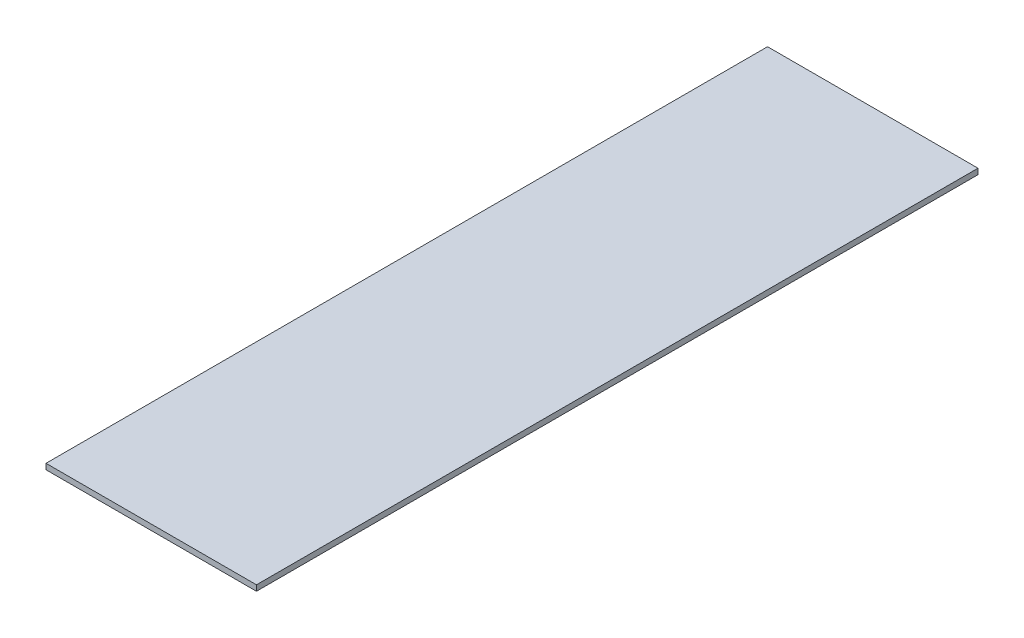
SolidWorks part; units mm, degrees
ref_plane "Front Plane" through (0, 0, 0) normal (0, 0, 1) x (1, 0, 0)
ref_plane "Top Plane" through (0, 0, 0) normal (0, 1, 0) x (1, 0, 0)
ref_plane "Right Plane" through (0, 0, 0) normal (1, 0, 0) x (0, 0, -1)
sketch "Sketch1" plane through (0, 0, 0) normal (0, 1, 0) x (1, 0, 0)
  line L1 (-177.8, -609.6) -> (177.8, -609.6)
  line L2 (-177.8, -609.6) -> (-177.8, 609.6)
  line L3 (-177.8, 609.6) -> (177.8, 609.6)
  line L4 (177.8, -609.6) -> (177.8, 609.6)
  line L5 (-177.8, -609.6) -> (177.8, 609.6) construction
  line L6 (-177.8, 609.6) -> (177.8, -609.6) construction
  point P0 (0, 0)
  dimension "D1" = 1219.2
  dimension "D2" = 355.6
extrude "Boss-Extrude1" add sketch "Sketch1" along normal mid plane 9.525
